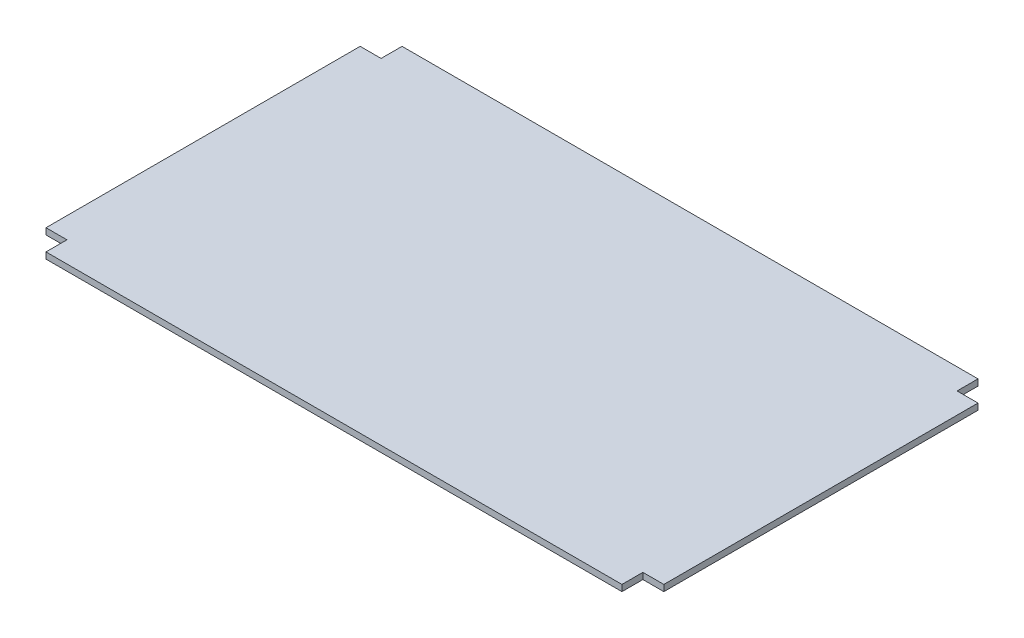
SolidWorks part; units mm, degrees
ref_plane "Front Plane" through (0, 0, 0) normal (0, 0, 1) x (1, 0, 0)
ref_plane "Top Plane" through (0, 0, 0) normal (0, 1, 0) x (1, 0, 0)
ref_plane "Right Plane" through (0, 0, 0) normal (1, 0, 0) x (0, 0, -1)
sketch "Sketch1" plane through (0, 0, 0) normal (0, 1, 0) x (1, 0, 0)
  line L0 (0, 340) -> (0, -340) construction
  line L5 (-550, -340) -> (550, -340)
  line L6 (-590, -300) -> (-590, 300)
  line L7 (-550, 340) -> (550, 340)
  line L8 (590, -300) -> (590, 300)
  line L9 (590, 0) -> (-590, 0) construction
  line L15 (590, -300) -> (550, -300)
  line L16 (550, -340) -> (550, -300)
  line L19 (-590, -300) -> (-550, -300)
  line L20 (-550, -340) -> (-550, -300)
  line L23 (-590, 300) -> (-550, 300)
  line L24 (-550, 340) -> (-550, 300)
  line L25 (590, 300) -> (550, 300)
  line L26 (550, 340) -> (550, 300)
  point P0 (0, 0)
  point P19 (0, -340)
  point P20 (0, 0)
  dimension "D1" = 40
  dimension "D2" = 40
  dimension "D3" = 1180
  dimension "D4" = 680
  dimension "D5" = 40
  dimension "D6" = 40
  dimension "D7" = 40
  dimension "D8" = 40
  dimension "D9" = 40
  dimension "D10" = 40
extrude "Boss-Extrude1" add sketch "Sketch1" along normal mid plane 12
